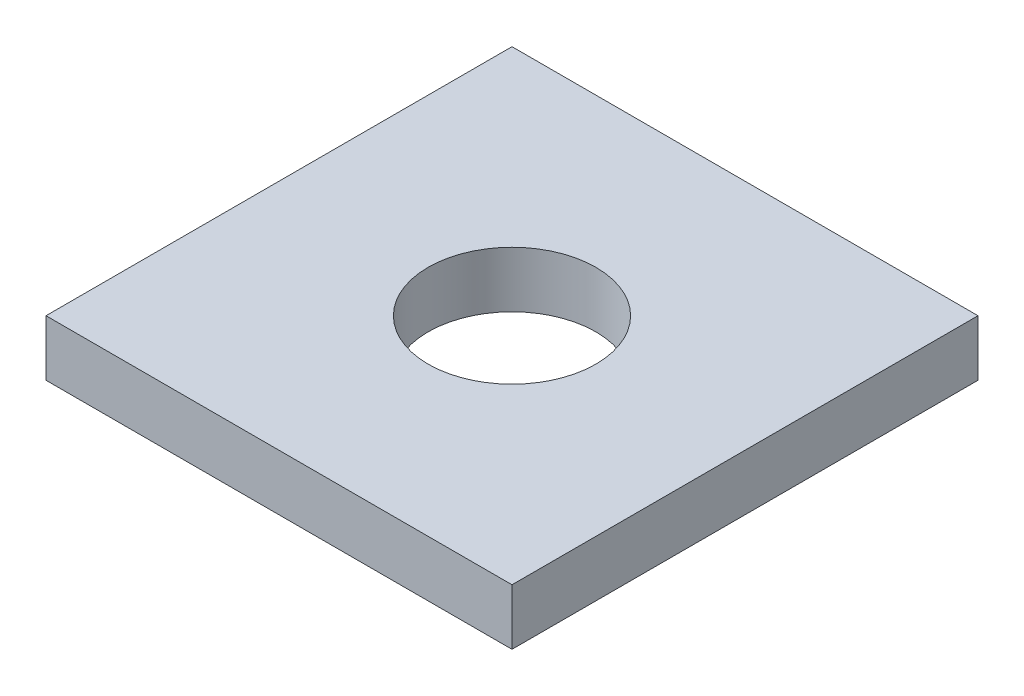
SolidWorks part; units mm, degrees
ref_plane "Front Plane" through (0, 0, 0) normal (0, 0, 1) x (1, 0, 0)
ref_plane "Top Plane" through (0, 0, 0) normal (0, 1, 0) x (1, 0, 0)
ref_plane "Right Plane" through (0, 0, 0) normal (1, 0, 0) x (0, 0, -1)
sketch "Sketch1" plane through (0, 0, 0) normal (0, 1, 0) x (1, 0, 0)
  line L0 (25, 25) -> (0, 0) construction
  line L1 (0, 0) -> (25, 0)
  line L2 (0, 0) -> (0, 25)
  line L3 (0, 25) -> (25, 25)
  line L4 (25, 0) -> (25, 25)
  circle A0 centre (12.5, 12.5) radius 4.5
  dimension "D3" = 9
  dimension "D1" = 25
  dimension "D2" = 25
extrude "Extrude1" add sketch "Sketch1" along normal blind 3
